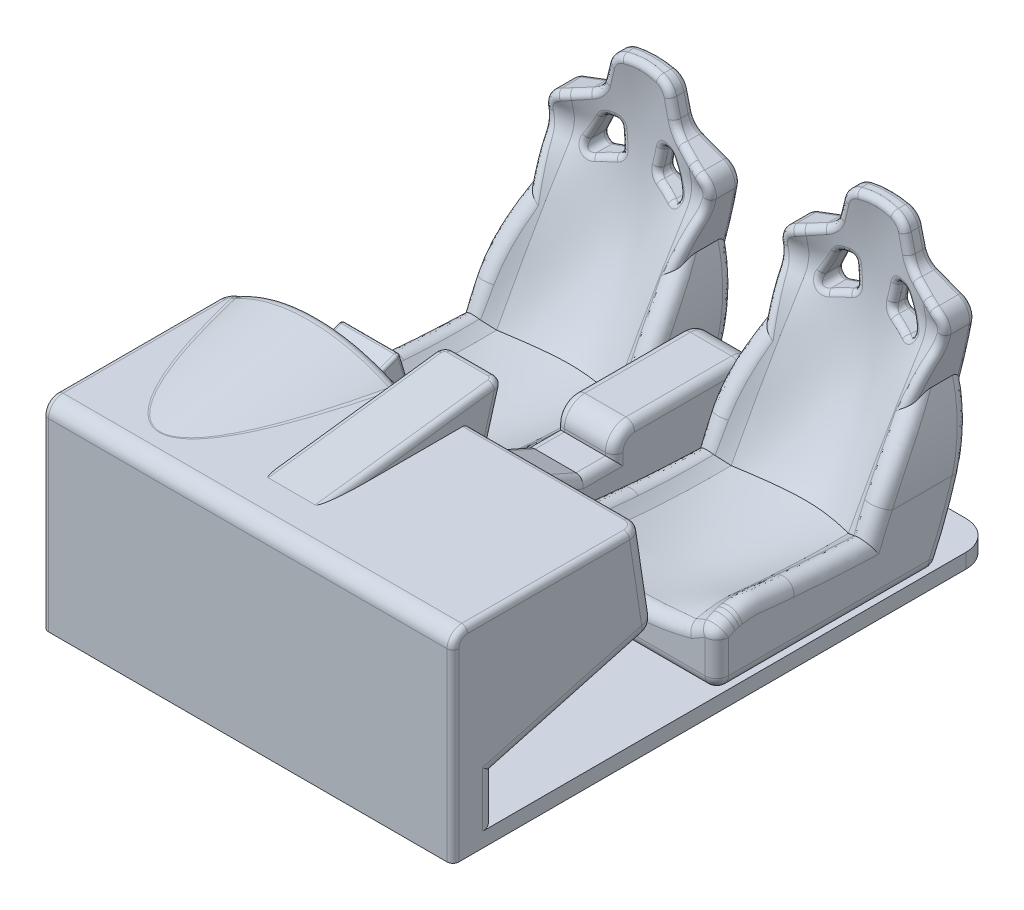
SolidWorks part; units mm, degrees
ref_plane "正面" through (0, 0, 0) normal (0, 0, 1) x (1, 0, 0)
ref_plane "平面" through (0, 0, 0) normal (0, 1, 0) x (1, 0, 0)
ref_plane "右側面" through (0, 0, 0) normal (1, 0, 0) x (0, 0, -1)
body saved out of another part "ｽﾄｯｸ-ORカー構想-1"
sketch "ｽｹｯﾁ1" plane through (0, -13, 0) normal (0, 1, 0) x (1, 0, 0)
  line L4 (70, 135) -> (70, 225)
  line L5 (70, 225) -> (-70, 225)
  line L6 (-70, 225) -> (-70, 135)
  line L7 (-70, 135) -> (70, 135)
  line L8 (70, 135) -> (70, 225)
  line L9 (70, 225) -> (-70, 225)
  line L10 (-70, 225) -> (-70, 135)
  line L11 (-70, 135) -> (70, 135)
  dimension "D1" = 0
surface "ｻｰﾌｪｽ-平面1" sketch "ｽｹｯﾁ1"
other "分割サーフェス"
split "部品分割1"
other "シート"
other "ダッシュボード"
sketch "ｽｹｯﾁ2" plane through (0, 0, 0) normal (1, 0, 0) x (0, 0, -1)
  line L0 (115, -13) -> (115, 50) construction
  line L1 (115, -13) -> (115, 17)
  line L2 (115, -13) -> (60, -13)
  line L3 (60, -13) -> (60, 2)
  line L4 (60, 2) -> (115, 17)
  line L5 (45, 50) -> (45, -18) construction
  dimension "D1" = 15
  dimension "D2" = 30
  dimension "D3" = 15
extrude "押し出し1" cut sketch "ｽｹｯﾁ2" against normal through all and the other way through all
sketch "ｽｹｯﾁ3" plane through (0, 0, 0) normal (1, 0, 0) x (0, 0, -1)
  line L0 (115, 17) -> (115, 50) construction
  line L1 (115, 17) -> (115, 50)
  line L2 (115, 17) -> (110, 50)
  line L3 (115, 50) -> (45, 50) construction
  line L4 (110, 50) -> (115, 50)
  dimension "D1" = 5
extrude "押し出し2" cut sketch "ｽｹｯﾁ3" against normal through all and the other way through all
sketch "ｽｹｯﾁ4" plane through (0, 0, 0) normal (1, 0, 0) x (0, 0, -1)
  line L0 (60, 2) -> (60, -13) construction
  line L1 (60, 50) -> (60, -13)
  line L2 (110, 50) -> (45, 50) construction
  line L3 (60, 50) -> (123, 58)
  line L4 (123, 58) -> (117, 37)
  line L5 (117, 37) -> (132, 22)
  line L6 (132, 22) -> (210, 22)
  line L7 (210, 22) -> (210, -13)
  line L8 (230, -13) -> (60, -13) construction
  line L9 (210, -13) -> (60, -13)
  dimension "D1" = 63
  dimension "D2" = 15
  dimension "D3" = 8
  dimension "D4" = 15
  dimension "D5" = 35
  dimension "D6" = 78
  dimension "D7" = 150
extrude "押し出し3" add sketch "ｽｹｯﾁ4" along normal mid plane 20
sketch "ｽｹｯﾁ5" plane through (0, 0, 0) normal (1, 0, 0) x (0, 0, -1)
  line L0 (132, 22) -> (150, 14)
  line L1 (150, 14) -> (160, 14)
  line L2 (160, 14) -> (160, 22)
  line L3 (210, 22) -> (132, 22) construction
  line L4 (210, -13) -> (210, 22) construction
  dimension "D1" = 10
  dimension "D2" = 50
  dimension "D3" = 8
extrude "押し出し4" cut sketch "ｽｹｯﾁ5" against normal through all and the other way through all
sketch "インパネスケッチ" plane through (0, 17.4147, -114.9372) normal (0, 0.1498, -0.9887) x (-1, 0, 0)
  line L0 (70, 32.9572) -> (10, 32.9572) construction
  line L1 (40, -0.4195) -> (40, 53.6173) construction
  line L2 (12.5, 32.9572) -> (67.5, 32.9572)
  line L3 (70, -0.4195) -> (10, -0.4195) construction
  arc A0 (12.5, 32.9572) -> (67.5, 32.9572) centre (40, -8.801) cw
  dimension "D1" = 50
  dimension "D2" = 55
extrude "押し出し5" add sketch "インパネスケッチ" against normal up to next
fillet "ﾌｨﾚｯﾄ1" radius 7 2 edges at (0, 22, -210) (0, 22, -160)
fillet "ﾌｨﾚｯﾄ2" radius 5 9 edges at (-70, -5.5, -60) (-70, 9.5, -87.5) (-40, 17, -115) (70, 9.5, -87.5) (70, -5.5, -60) (-70, 33.5, -112.5) (70, 33.5, -112.5) (40, 17, -115) (0, 50, -45)
fillet "ﾌｨﾚｯﾄ3" radius 3 19 edges at (10, 1, -210) (10, 14.5, -160) (10, 19.9497, -162.0503) (10, 22, -185) (-10, 14.5, -160) (-10, 19.9497, -162.0503) (-10, 22, -185) (-10, 1, -210) (10, 47.5, -120) (10, 29.5, -124.5) (10, 18, -141) (10, 14, -155) (10, 19.9497, -207.9497) (-10, 19.9497, -207.9497) (-10, 47.5, -120) (-10, 29.5, -124.5) (-10, 18, -141) (-10, 14, -155) (-38.5311, 58.1274, -108.7686)
fillet "ﾌｨﾚｯﾄ4" radius 2 18 edges at (10, 53.7944, -89.8812) (9.1213, 57.8796, -122.0518) (0, 58, -123) (-9.1213, 57.8796, -122.0518) (70, 13.5, -45) (70, 48.5355, -46.4645) (70, 50, -77.4715) (68.5355, 50, -108.5188) (-10, 53.7944, -89.8812) (37.5, 50, -110) (-70, 13.5, -45) (-70, 48.5355, -46.4645) (-70, 50, -77.4715) (-13.7393, 50, -108.6403) (-66.6443, 50, -108.1282) (-68.029, 50, -108.9664) (-40, 50, -54.9835)
sketch "ｽｹｯﾁ7" plane through (0, 17.4147, -114.9372) normal (0, 0.1498, -0.9887) x (-1, 0, 0)
  line L0 (40, -8.801) -> (40, 43.4285) construction
  line L1 (62.5, 31.3206) -> (57.5, 22.199)
  line L2 (17.5, 31.3206) -> (22.5, 22.199)
  line L3 (22.5, 22.199) -> (57.5, 22.199)
  arc A2 (64.4681, 30.1517) -> (22.5287, 33.7519) centre (40, -8.801) ccw
  arc A3 (62.5, 31.3206) -> (17.5, 31.3206) centre (40, -8.801) ccw
  dimension "D2" = 15
  dimension "D3" = 35
  dimension "D4" = 45
  dimension "D1" = 1
extrude "押し出し6" cut sketch "ｽｹｯﾁ7" against normal blind 5
fillet "ﾌｨﾚｯﾄ5" radius 1 12 edges at (-40, 38.6141, -106.6681) (-57.5, 38.9887, -109.1399) (-20, 43.1235, -105.9848) (-22.5, 38.9887, -109.1399) (-40, 53.4449, -104.421) (-17.5, 48.0074, -107.7734) (-60, 43.1235, -105.9848) (-62.5, 48.0074, -107.7734) (-40, 39.3632, -111.6116) (-60, 43.8725, -110.9284) (-40, 54.1939, -109.3646) (-20, 43.8725, -110.9284)
ref_plane "シート中心面" through (-40, 0, 0) normal (1, 0, 0) x (0, 0, -1)
sketch "ｽｹｯﾁ8" plane through (0, 0, -135) normal (0, 0, 1) x (1, 0, 0)
  line L0 (-10, 93.722) -> (-10, -45.3393)
  line L1 (-10, 48.2996) -> (-10, 21.4015) construction
extrude "押し出し7" cut sketch "ｽｹｯﾁ8" against normal through all and the other way through all
sketch "シート側面" plane through (-40, 0, 0) normal (1, 0, 0) x (0, 0, -1)
  line L0 (135, 77) -> (225, 77) construction
  line L1 (184.6259, 9) -> (149.6259, 13.7432)
  line L2 (135, -13) -> (135, 77) construction
  line L3 (225, 77) -> (225, -13) construction
  line L4 (135, -13) -> (225, -13) construction
  arc A0 (212.5, 77) -> (212.5, 57) centre (229.8205, 67) ccw
  arc A1 (212.5, 57) -> (210.6205, 49) centre (207.3038, 54) cw
  arc A2 (210.6205, 49) -> (184.6259, 9) centre (243.7867, -1) ccw
  arc A3 (149.6259, 13.7432) -> (135, 7) centre (147.6115, -1.1209) ccw
  dimension "D2" = 15
  dimension "D5" = 60
  dimension "D6" = 6
  dimension "D7" = 20
  dimension "D1" = 12.5
  dimension "D3" = 20
  dimension "D4" = 35
  dimension "D8" = 20
  dimension "D9" = 8
  dimension "D10" = 68
extrude "押し出し8" cut sketch "シート側面" against normal through all and the other way through all flip side to cut
sketch "ｽｹｯﾁ10" plane through (0, 0, -225) normal (0, 0, -1) x (-1, 0, 0)
  line L0 (40, -13) -> (40, 79.2515) construction
  line L1 (10, -13) -> (70, -13) construction
  line L2 (50, 75.2843) -> (53, 63)
  line L3 (53, 63) -> (69, 57)
  line L4 (69, 57) -> (65.3835, 37)
  line L5 (70, -13) -> (70, 77) construction
  line L6 (11, 57) -> (14.6165, 37)
  line L7 (27, 63) -> (11, 57)
  line L8 (30, 75.2843) -> (27, 63)
  line L9 (10, 77) -> (10, -13) construction
  line L10 (10, 77) -> (70, 77) construction
  arc A0 (65.3835, 37) -> (70, 12) centre (0, 12) cw
  arc A1 (14.6165, 37) -> (10, 12) centre (80, 12) ccw
  arc A2 (30, 75.2843) -> (50, 75.2843) centre (40, 47) cw
  dimension "D1" = 20
  dimension "D8" = 70
  dimension "D9" = 30
  dimension "D2" = 26
  dimension "D3" = 58
  dimension "D4" = 6
  dimension "D5" = 20
  dimension "D6" = 50
  dimension "D7" = 25
extrude "押し出し9" cut sketch "ｽｹｯﾁ10" against normal through all and the other way through all flip side to cut
sketch "座面ガイド" plane through (0, 0, -135) normal (0, 0, 1) x (1, 0, 0)
  line L0 (-40, -13) -> (-40, 7) construction
  line L1 (-10, -13) -> (-70, -13) construction
  line L2 (-10, 7) -> (-70, 7) construction
  arc A0 (-10, 7) -> (-20, 2.393) centre (-40, 58.9615) cw
  arc A1 (-70, 7) -> (-60, 2.393) centre (-40, 58.9615) ccw
  arc A2 (-60, 2.393) -> (-20, 2.393) centre (-40, 201.3905) ccw
  dimension "D1" = 60
  dimension "D3" = 200
  dimension "D2" = 40
sketch "座面中央" plane through (-40, 0, 0) normal (1, 0, 0) x (0, 0, -1)
  line L0 (225, 77) -> (212.5, 77) construction
  line L1 (135, -13) -> (225, -13) construction
  line L2 (225, 12) -> (225, -13) construction
  arc A0 (135, 1.3905) -> (195, 0) centre (169.1119, 178.1286) ccw
  arc A1 (195, 0) -> (218.75, 77) centre (129.9719, 62.2201) ccw
  dimension "D1" = 90
  dimension "D3" = 30
  dimension "D4" = 180
  dimension "D2" = 13
sketch "座面左" plane through (-10, 0, 0) normal (1, 0, 0) x (0, 0, -1)
  line L0 (184.6259, 9) -> (149.6259, 13.7432) construction
  line L1 (184.6259, 9) -> (149.6259, 13.7432)
  arc A0 (149.6259, 13.7432) -> (135, 7) centre (147.6115, -1.1209) ccw construction
  arc A1 (210.6205, 49) -> (184.6259, 9) centre (243.7867, -1) ccw construction
  arc A2 (210.6205, 49) -> (212.5, 57) centre (207.3038, 54) ccw construction
  arc A3 (212.5, 77) -> (212.5, 57) centre (229.8205, 67) ccw construction
  arc A4 (149.6259, 13.7432) -> (135, 7) centre (147.6115, -1.1209) ccw
  arc A5 (210.6205, 49) -> (184.6259, 9) centre (243.7867, -1) ccw
  arc A6 (210.6205, 49) -> (212.5, 57) centre (207.3038, 54) ccw
  arc A7 (212.5, 77) -> (212.5, 57) centre (229.8205, 67) ccw
sketch "座面右" plane through (-70, 0, 0) normal (-1, 0, 0) x (0, 0, 1)
  line L0 (-184.6259, 9) -> (-149.6259, 13.7432) construction
  line L1 (-184.6259, 9) -> (-149.6259, 13.7432)
  arc A0 (-135, 7) -> (-149.6259, 13.7432) centre (-147.6115, -1.1209) ccw construction
  arc A1 (-184.6259, 9) -> (-210.6205, 49) centre (-243.7867, -1) ccw construction
  arc A2 (-212.5, 57) -> (-210.6205, 49) centre (-207.3038, 54) ccw construction
  arc A3 (-212.5, 57) -> (-212.5, 77) centre (-229.8205, 67) ccw construction
  arc A4 (-135, 7) -> (-149.6259, 13.7432) centre (-147.6115, -1.1209) ccw
  arc A5 (-184.6259, 9) -> (-210.6205, 49) centre (-243.7867, -1) ccw
  arc A6 (-212.5, 57) -> (-210.6205, 49) centre (-207.3038, 54) ccw
  arc A7 (-212.5, 57) -> (-212.5, 77) centre (-229.8205, 67) ccw
surface "ｻｰﾌｪｽ-ﾛﾌﾄ1"
other "座面サーフェス"
other "ｻｰﾌｪｽ ｶｯﾄ1"
sketch "ｽｹｯﾁ16" plane through (-40, 0, 0) normal (1, 0, 0) x (0, 0, -1)
  line L0 (135, -13) -> (225, -13) construction
  line L1 (225, 37) -> (225, 57) construction
  line L2 (225, 12) -> (225, 37) construction
  line L3 (225, 12) -> (225, -13) construction
  arc A0 (210, -13) -> (225, 52.3835) centre (75, 52.3835) ccw
  dimension "D2" = 150
  dimension "D1" = 15
extrude "押し出し10" cut sketch "ｽｹｯﾁ16" along normal through all and the other way through all flip side to cut
sketch "ｽｹｯﾁ17" plane through (0, 0, -135) normal (0, 0, 1) x (1, 0, 0)
  line L0 (-40, -13) -> (-40, 82.6428) construction
  line L1 (-10, -13) -> (-70, -13) construction
  line L2 (-32.562, 56) -> (-34, 47)
  line L3 (-34, 47) -> (-22, 43)
  line L4 (-22, 43) -> (-28.062, 56)
  line L5 (-28.062, 56) -> (-32.562, 56)
  line L6 (-51.938, 56) -> (-47.438, 56)
  line L7 (-58, 43) -> (-51.938, 56)
  line L8 (-46, 47) -> (-58, 43)
  line L9 (-47.438, 56) -> (-46, 47)
  dimension "D1" = 12
  dimension "D2" = 4
  dimension "D3" = 13
  dimension "D4" = 4.5
  dimension "D5" = 50
  dimension "D6" = 56
  dimension "D7" = 36
extrude "押し出し11" cut sketch "ｽｹｯﾁ17" against normal through all
fillet "ﾌｨﾚｯﾄ6" radius 6 6 edges at (-11, 57, -218.8549) (-27, 63, -221.3469) (-30, 75.2843, -221.4856) (-50, 75.2843, -221.4856) (-53, 63, -221.3469) (-69, 57, -218.8549)
fillet "ﾌｨﾚｯﾄ7" radius 4 30 edges at (-40, -13, -135) (-10, -13, -172.5) (-10, 10.5, -173.5575) (-70, 10.5, -173.5575) (-10.6319, 21.3847, -188.8942) (-68.7224, 25.313, -191.5781) (-69.9814, 13.6124, -150.4455) (-10.0189, 13.6269, -144.9858) (-70, -13, -172.5) (-70, -0.7112, -215.2888) (-10, -0.7112, -215.2888) (-40, -13, -210)
fillet "ﾌｨﾚｯﾄ8" radius 2 60 edges at (-13.4576, 43.409, -207.7479) (-65.9481, 40.1224, -224.498) (-33.57, 49.6913, -224.9758) (-27.998, 44.9993, -224.8181) (-24.1867, 47.6894, -224.9265) (-30.312, 56, -225) (-25.6588, 50.8463, -217.6693) (-27.2188, 54.1917, -225) (-23.521, 43.507, -214.6474) (-32.8509, 54.1917, -225) (-32.562, 56, -222.0759) (-28.062, 56, -221.6282) (-22, 43, -219.2457) (-34, 47, -221.6037) (-52.002, 44.9993, -224.8181) (-46.43, 49.6913, -224.9758) (-55.8133, 47.6894, -224.9265) (-49.688, 56, -225) (-55.6689, 47.999, -216.8047) (-52.7812, 54.1917, -225) (-47.1491, 54.1917, -225) (-47.6814, 46.4395, -217.9514) (-58, 43, -219.2457) (-51.938, 56, -221.6282) (-47.438, 56, -222.0759) (-46, 47, -221.6037) (-14.0519, 40.1224, -224.498) (-13.1344, 56.9186, -213.3181) (-19.8595, 60.3223, -225) (-60.1405, 60.3223, -225) (-51.5374, 68.9891, -225) (-40, 77, -225) (-28.4626, 68.9891, -225) (-67.3424, 56.2393, -225) (-49.1776, 74.7789, -225) (-30.8224, 74.7789, -225) (-12.6576, 56.2393, -225) (-39.0921, 76.9863, -218.7435) (-49.6494, 74.2644, -218.1141) (-31.3158, 75.2082, -218.2162) (-67.3271, 47.7488, -211.5478) (-66.9049, 56.8696, -213.326) (-25.7616, 62.8924, -217.2831) (-26.4116, 63.5221, -225) (-53.0104, 64.2893, -217.6443) (-53.5884, 63.5221, -225) (-65.2126, 36.0551, -221.8762) (-14.9156, 35.346, -208.3387)
mirror "ﾐﾗｰ1" about plane through (0, 0, 0) normal (1, 0, 0)
sketch "ｽｹｯﾁ18" plane through (-40, 0, 0) normal (1, 0, 0) x (0, 0, -1)
  line L0 (111.9697, 37) -> (126.9697, 42.4596)
  line L1 (110.2576, 48.2996) -> (114.3331, 21.4015) construction
  line L2 (126.9697, 42.4596) -> (129.9697, 32.4596)
  line L3 (129.9697, 32.4596) -> (111.9697, 22)
  line L4 (111.9697, 22) -> (111.9697, 37)
  line L5 (47, -18) -> (230, -18) construction
  dimension "D1" = 110
  dimension "D2" = 10
  dimension "D3" = 15
  dimension "D4" = 18
  dimension "D5" = 15
  dimension "D6" = 55
extrude "押し出し12" add sketch "ｽｹｯﾁ18" along normal mid plane 20
sketch "ｽｹｯﾁ19" plane through (0, 38.4516, -128.1721) normal (0, 0.2873, -0.9578) x (-1, 0, 0)
  line L0 (40, 4.1844) -> (40, -6.2559) construction
  line L1 (30, 4.1844) -> (50, 4.1844) construction
  line L2 (30, -6.2559) -> (50, -6.2559) construction
  circle A0 centre (40, -1.0358) radius 3
  dimension "D1" = 6
extrude "押し出し13" cut sketch "ｽｹｯﾁ19" against normal blind 10
fillet "ﾌｨﾚｯﾄ9" radius 1 13 edges at (-30, 30.1069, -113.0141) (-50, 30.1069, -113.0141) (-50, 27.8367, -122.0141) (-40, 23.2138, -114.0585) (-30, 27.8367, -122.0141) (-40, 32.4596, -129.9697) (-30, 37.4596, -128.4697) (-50, 37.4596, -128.4697) (-40, 40.333, -127.6077) (-40, 42.4596, -126.9697) (-30, 39.7298, -119.4697) (-40, 37, -111.9697) (-50, 39.7298, -119.4697)
fillet "ﾌｨﾚｯﾄ10" radius 10 2 edges at (-70, -15.5, -230) (70, -15.5, -230)
